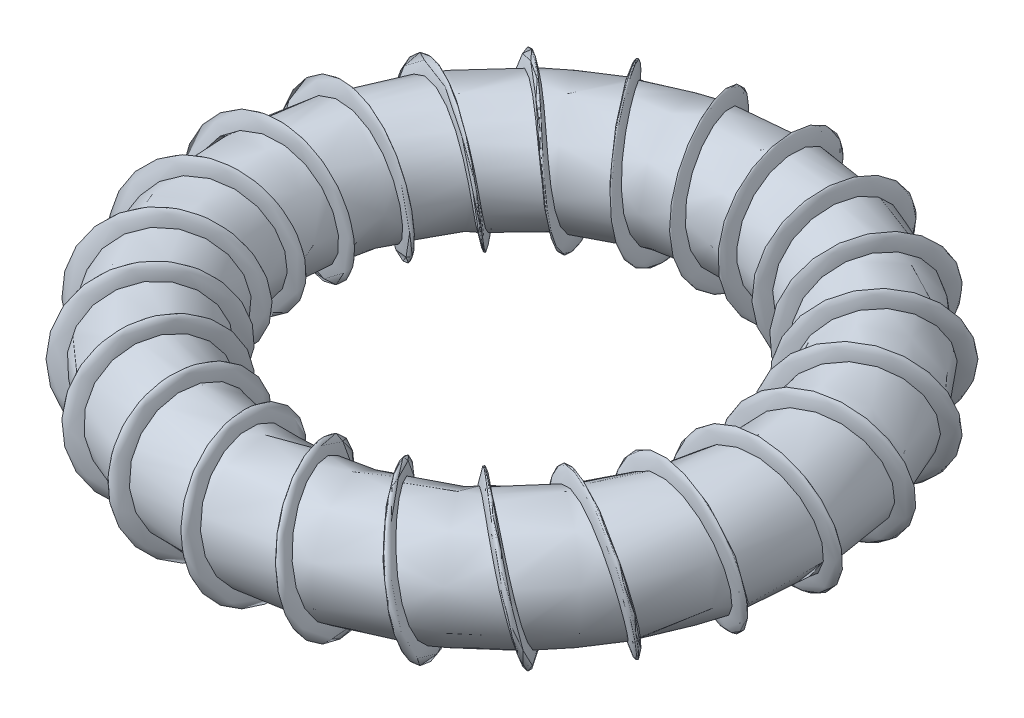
SolidWorks part; units mm, degrees
ref_plane "Front Plane" through (0, 0, 0) normal (0, 0, 1) x (1, 0, 0)
ref_plane "Top Plane" through (0, 0, 0) normal (0, 1, 0) x (1, 0, 0)
ref_plane "Right Plane" through (0, 0, 0) normal (1, 0, 0) x (0, 0, -1)
sketch "Sketch1" plane through (0, 0, 0) normal (0, 0, 1) x (1, 0, 0)
  line L0 (0, 0) -> (0, 75.0627) construction
  circle A0 centre (174.1985, 0) radius 39.5797
revolve "Revolve1" add sketch "Sketch1" angle 360 about L0
sketch "Sketch2" plane through (0, 0, 0) normal (0, 1, 0) x (1, 0, 0)
  circle A0 centre (0, 0) radius 174.1985
sketch "Sketch3" plane through (0, 0, 0) normal (0, 0, 1) x (1, 0, 0)
  circle A0 centre (209.7952, 0) radius 13.9281
sweep "Sweep1" add profiles "Sketch3" path "Sketch2" parameters "D1"=8640
